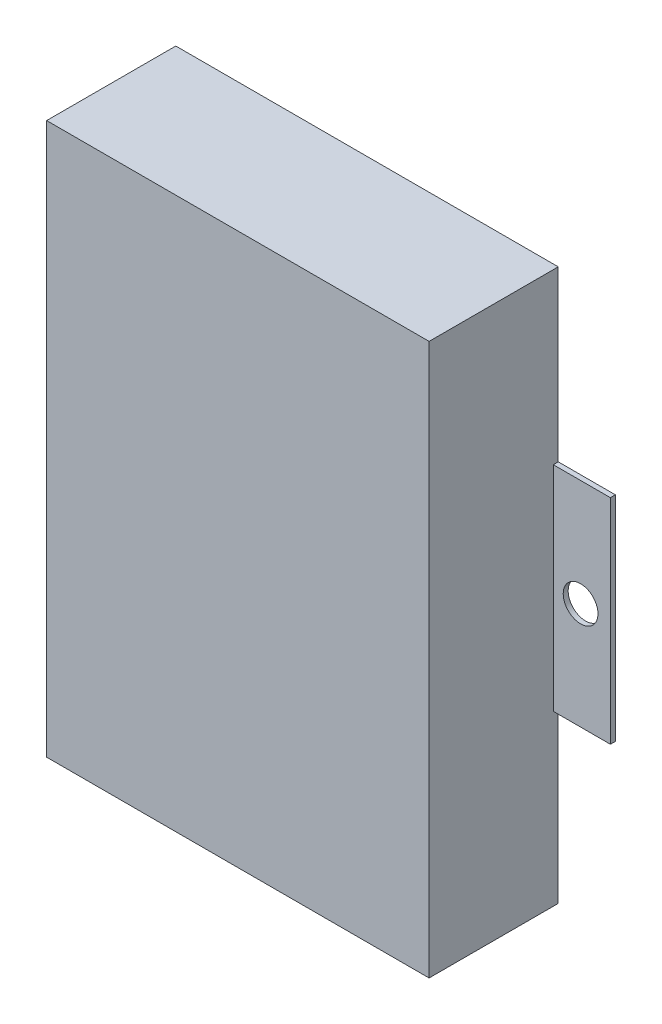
SolidWorks part; units mm, degrees
ref_plane "Plan de face" through (0, 0, 0) normal (0, 0, 1) x (1, 0, 0)
ref_plane "Plan de dessus" through (0, 0, 0) normal (0, 1, 0) x (1, 0, 0)
ref_plane "Plan de droite" through (0, 0, 0) normal (1, 0, 0) x (0, 0, -1)
sketch "Esquisse1" plane through (0, 0, 0) normal (0, 0, 1) x (1, 0, 0)
  line L1 (0, 0) -> (77, 0)
  line L2 (0, 0) -> (0, 111)
  line L3 (0, 111) -> (77, 111)
  line L4 (77, 0) -> (77, 111)
  dimension "D1" = 77
  dimension "D2" = 111
extrude "Extrusion1" add sketch "Esquisse1" along normal blind 26
sketch "Esquisse3"
sketch "Esquisse4" plane through (0, 0, 0) normal (0, 0, -1) x (-1, 0, 0)
  line L0 (-77, 0) -> (-77, 111) construction
  line L1 (-77, 77) -> (-88.5, 77)
  line L2 (-77, 77) -> (-77, 34)
  line L3 (-77, 34) -> (-88.5, 34)
  line L4 (-88.5, 77) -> (-88.5, 34)
  line L5 (-77, 111) -> (0, 111) construction
  line L6 (0, 111) -> (0, 0) construction
  line L7 (0, 77) -> (11.5, 77)
  line L8 (0, 77) -> (0, 34)
  line L9 (0, 34) -> (11.5, 34)
  line L10 (11.5, 77) -> (11.5, 34)
  line L11 (-77, 111) -> (0, 111) construction
  circle A0 centre (-82.5, 55.5) radius 3.5
  circle A1 centre (5.5, 55.5) radius 3.5
  point P18 (-38.5, 111)
  dimension "D4" = 7
  dimension "D7" = 7
  dimension "D8" = 88
  dimension "D9" = 44
  dimension "D10" = 21.5
  dimension "D11" = 21.5
  dimension "D1" = 43
  dimension "D2" = 11.5
  dimension "D3" = 34
  dimension "D5" = 11.5
  dimension "D6" = 43
extrude "Extrusion2" add sketch "Esquisse4" against normal blind 1
